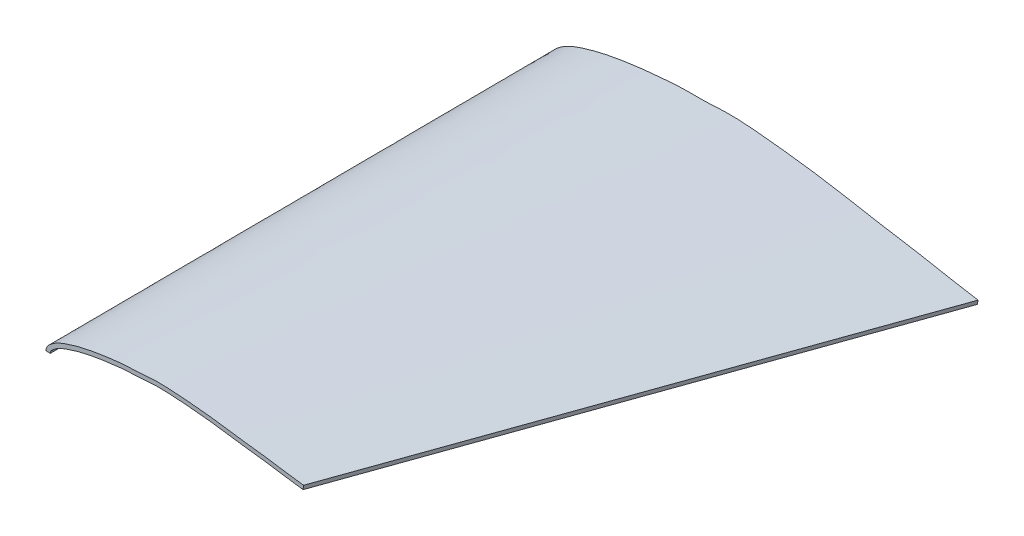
SolidWorks part; units mm, degrees
ref_plane "Front Plane" through (0, 0, 0) normal (0, 0, 1) x (1, 0, 0)
ref_plane "Top Plane" through (0, 0, 0) normal (0, 1, 0) x (1, 0, 0)
ref_plane "Right Plane" through (0, 0, 0) normal (1, 0, 0) x (0, 0, -1)
curve "Curve1"
sketch "Sketch2" plane through (0, 0, 0) normal (0, 0, 1) x (1, 0, 0)
  spline S1 degree 3 poles (-0.0644, 0.466) (-0.0522, 0.6178) (-0.0147, 1.0828) (0.4284, 1.6621) (0.9829, 2.155) (1.4896, 2.5496) (1.9905, 2.8962) (2.4948, 3.2006) (3.1563, 3.5711) (3.9831, 3.9838) (5.4777, 4.5831) (7.4836, 5.2154) (10.8006, 6.1395) (14.978, 6.9461) (19.986, 7.6859) (24.9938, 8.1518) (29.993, 8.6025) (35.0044, 8.3769) (41.6655, 8.9815) (50.0313, 8.2164) (60.0293, 7.0704) (70.0155, 5.4011) (78.3157, 3.8198) (85.0185, 2.8518) (89.989, 1.8052) (95.0016, 0.9656) (98.3339, 0.3719) (100, 0.075) knots 0 0 0 0 0.004398 0.013468 0.02008 0.02625 0.032162 0.037861 0.043438 0.054296 0.064805 0.090414 0.115644 0.165301 0.214472 0.263378 0.312146 0.360801 0.409512 0.506968 0.60497 0.703553 0.802364 0.851641 0.901187 0.950593 1 1 1 1
  spline S2 degree 3 poles (-0.0644, 0.466) (-0.0522, 0.6178) (-0.0147, 1.0828) (0.4284, 1.6621) (0.9829, 2.155) (1.4896, 2.5496) (1.9905, 2.8962) (2.4948, 3.2006) (3.1563, 3.5711) (3.9831, 3.9838) (5.4777, 4.5831) (7.4836, 5.2154) (10.8006, 6.1395) (14.978, 6.9461) (19.986, 7.6859) (24.9938, 8.1518) (29.993, 8.6025) (35.0044, 8.3769) (41.6655, 8.9815) (50.0313, 8.2164) (60.0293, 7.0704) (70.0155, 5.4011) (78.3157, 3.8198) (85.0185, 2.8518) (89.989, 1.8052) (95.0016, 0.9656) (98.3339, 0.3719) (100, 0.075) knots 0 0 0 0 0.004398 0.013468 0.02008 0.02625 0.032162 0.037861 0.043438 0.054296 0.064805 0.090414 0.115644 0.165301 0.214472 0.263378 0.312146 0.360801 0.409512 0.506968 0.60497 0.703553 0.802364 0.851641 0.901187 0.950593 1 1 1 1
  dimension "D1" = 0
ref_plane "Plane1" through (0, 0, 120) normal (0, 0, 1) x (1, 0, 0)
sketch "Sketch4" plane through (0, 0, 120) normal (0, 0, 1) x (1, 0, 0)
  spline S1 degree 3 poles (0, 0) (0.0039, 0.0913) (0.016, 0.3709) (0.2687, 0.7281) (0.5902, 1.036) (0.8852, 1.2839) (1.1777, 1.5029) (1.4733, 1.6966) (1.8616, 1.9335) (2.348, 2.1994) (3.2307, 2.5921) (4.4192, 3.0159) (6.3872, 3.644) (8.8736, 4.2209) (11.8595, 4.7762) (14.8514, 5.1674) (17.8385, 5.5492) (20.848, 5.5259) (24.828, 6.0371) (29.8607, 5.7652) (35.8803, 5.3014) (41.9046, 4.5236) (46.916, 3.7609) (50.9562, 3.3303) (53.9595, 2.8138) (56.9834, 2.4224) (58.9945, 2.1408) (60, 2) knots 0 0 0 0 0.004398 0.013468 0.02008 0.02625 0.032162 0.037861 0.043438 0.054296 0.064805 0.090414 0.115644 0.165301 0.214472 0.263378 0.312146 0.360801 0.409512 0.506968 0.60497 0.703553 0.802364 0.851641 0.901187 0.950593 1 1 1 1
  dimension "D1" = 2
  dimension "D2" = 60
sheet metal parameters "Sheet-Metal1" thickness 1 parameters "D1"=2
lofted bend "Lofted Bends2" parameters "D1"=0, "D12"=1
other "Freeform Bend1" parameters "D1"=1000, "D4"=57.296, "D5"=1
flat pattern "Flat-Pattern1"
sketch "Bend-Lines1" plane through (0, 0, 0) normal (0, 1, 0) x (-1, 0, 0)
other "Flatten-<Freeform Bend1>1"
